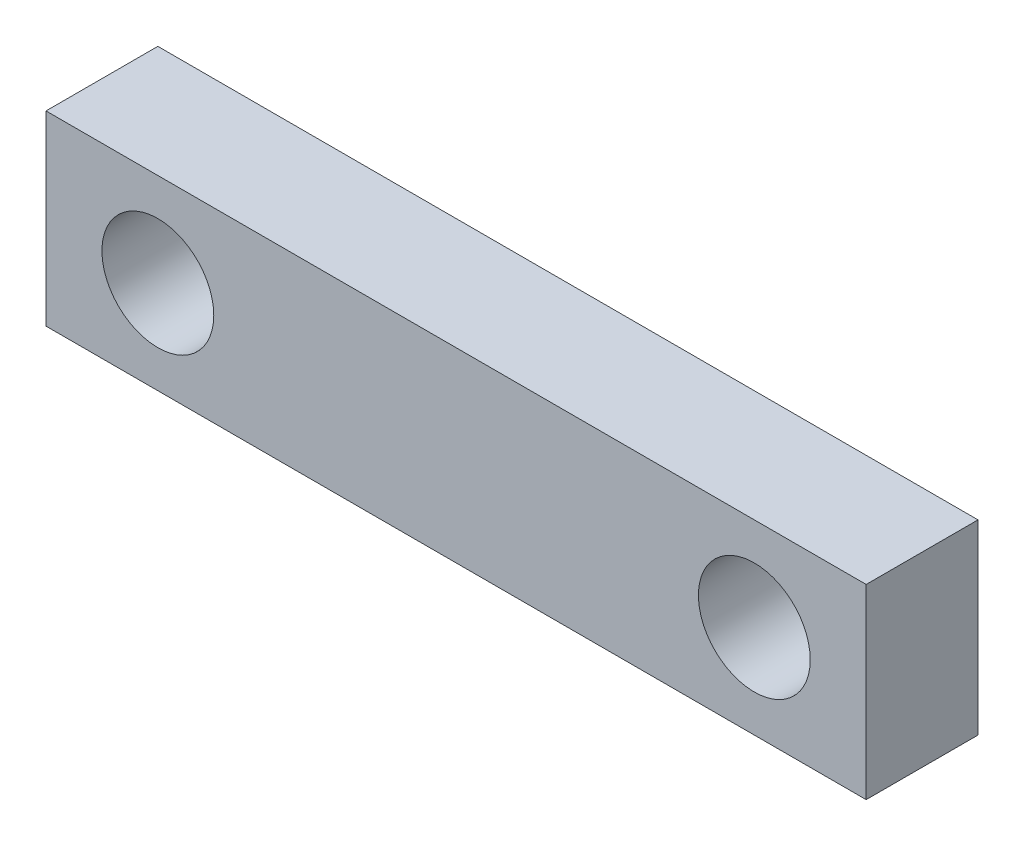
SolidWorks part; units mm, degrees
ref_plane "Face" through (0, 0, 0) normal (0, 0, 1) x (1, 0, 0)
ref_plane "Dessus" through (0, 0, 0) normal (0, 1, 0) x (1, 0, 0)
ref_plane "Droite" through (0, 0, 0) normal (1, 0, 0) x (0, 0, -1)
sketch "Esquisse1" plane through (0, 0, 0) normal (0, 0, 1) x (1, 0, 0)
  line L1 (0, 0) -> (110, 0)
  line L2 (0, 0) -> (0, 25)
  line L3 (0, 25) -> (110, 25)
  line L4 (110, 0) -> (110, 25)
  dimension "D1" = 110
  dimension "D2" = 25
extrude "Base-Extrusion" add sketch "Esquisse1" along normal blind 15
sketch "Esquisse2" plane through (0, 0, 15) normal (0, 0, 1) x (1, 0, 0)
  line L0 (0, 12.5) -> (15, 12.5) construction
  line L3 (0, 25) -> (0, 0) construction
  line L4 (110, 12.5) -> (95, 12.5) construction
  line L5 (110, 0) -> (110, 25) construction
  circle A0 centre (15, 12.5) radius 7.5
  circle A1 centre (95, 12.5) radius 7.5
  dimension "D1" = 15
  dimension "D2" = 80
extrude "Enlèv. mat.-Extru.1" cut sketch "Esquisse2" against normal through all
